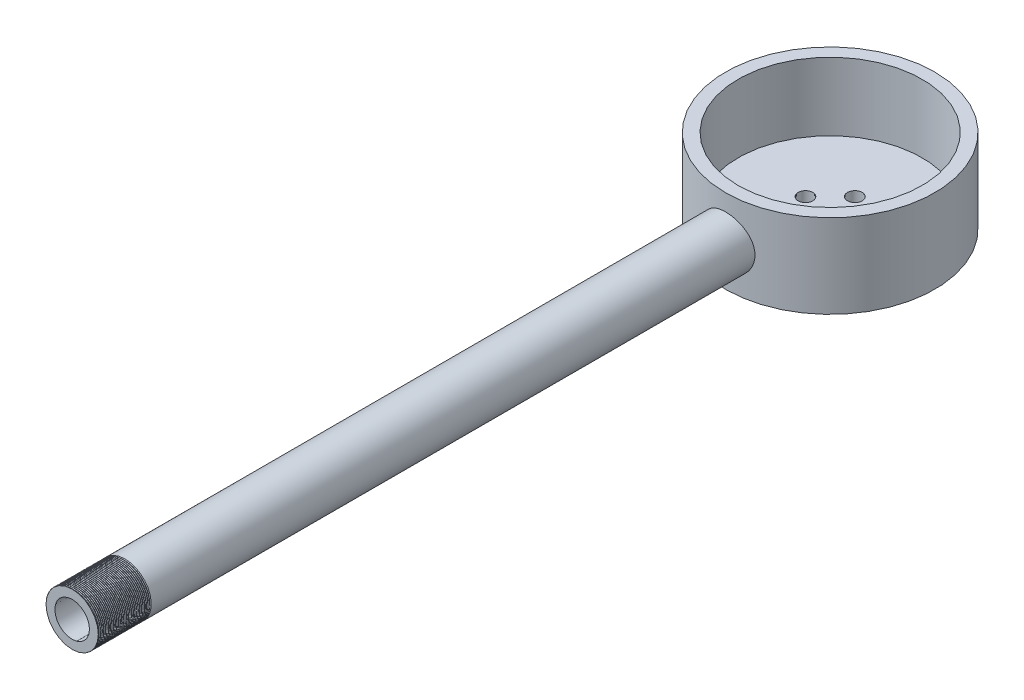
SolidWorks part; units mm, degrees
ref_plane "Front Plane" through (0, 0, 0) normal (0, 0, 1) x (1, 0, 0)
ref_plane "Top Plane" through (0, 0, 0) normal (0, 1, 0) x (1, 0, 0)
ref_plane "Right Plane" through (0, 0, 0) normal (1, 0, 0) x (0, 0, -1)
sketch "Sketch1" plane through (0, 0, 0) normal (0, 1, 0) x (1, 0, 0)
  circle A0 centre (0, 0) radius 25.4
  dimension "D1" = 50.8
extrude "Boss-Extrude4" add sketch "Sketch1" along normal blind 20.32
sketch "Sketch2" plane through (0, 20.32, 0) normal (0, 1, 0) x (1, 0, 0)
  circle A0 centre (0, 0) radius 22.352
  dimension "D1" = 44.704
extrude "Cut-Extrude1" cut sketch "Sketch2" against normal blind 16.51
sketch "Sketch3" plane through (0, 3.81, 0) normal (0, 1, 0) x (1, 0, 0)
  circle A0 centre (0, 0) radius 6 construction
  circle A1 centre (0, 6) radius 1.79
  dimension "D1" = 12
  dimension "D2" = 3.58
sketch "Sketch5" plane through (0, 0, 0) normal (0, 0, 1) x (1, 0, 0)
  point P4 (0, 9.9517)
ref_plane "Plane1" through (0, 0, 22.86) normal (0, 0, 1) x (1, 0, 0)
sketch "Sketch6" plane through (0, 0, 22.86) normal (0, 0, 1) x (1, 0, 0)
  circle A0 centre (0, 9.9517) radius 6.35
  dimension "D1" = 12.7
extrude "Boss-Extrude5" add sketch "Sketch6" along normal blind 161.163
thread "Thread1" pitch 0.3969 start angle 0, offset 0, length 12.7, pitch 0.3969, diameter 12.7
ref_plane "Plane2" through (-6.35, 9.9517, 184.023) normal (0, -1, 0) x (-1, 0, 0)
sketch "Thread Profile1" plane through (-6.35, 9.9517, 184.023) normal (0, -1, 0) x (-1, 0, 0)
  line L0 (0, 0) -> (0, 0.3969) construction
  line L11 (0, 0) -> (0, 0.3473)
  line L12 (0, 0.3473) -> (-0.2148, 0.2232)
  line L13 (-0.2148, 0.2232) -> (-0.2148, 0.124)
  line L15 (-0.2148, 0.124) -> (0, 0)
  line L17 (-0.2148, 0.1736) -> (0, 0.1736) construction
  point P2 (0, 0)
  dimension "Pitch" = 0.3969
  dimension "Profile_Angle" = 60
  dimension "Profile_Land" = 0.0992
  dimension "Profile_Height" = 0.2148
sketch "Sketch7" plane through (0, 0, 184.023) normal (0, 0, 1) x (1, 0, 0)
  circle A0 centre (0, 9.9517) radius 4.2046
extrude "Cut-Extrude2" cut sketch "Sketch7" against normal up to next
extrude "Cut-Extrude3" cut sketch "Sketch3" against normal through all
pattern_circular "CirPattern1" count 4 over 360 about axis through (0, 0, 0) along (0, 1, 0) of "Cut-Extrude3"
